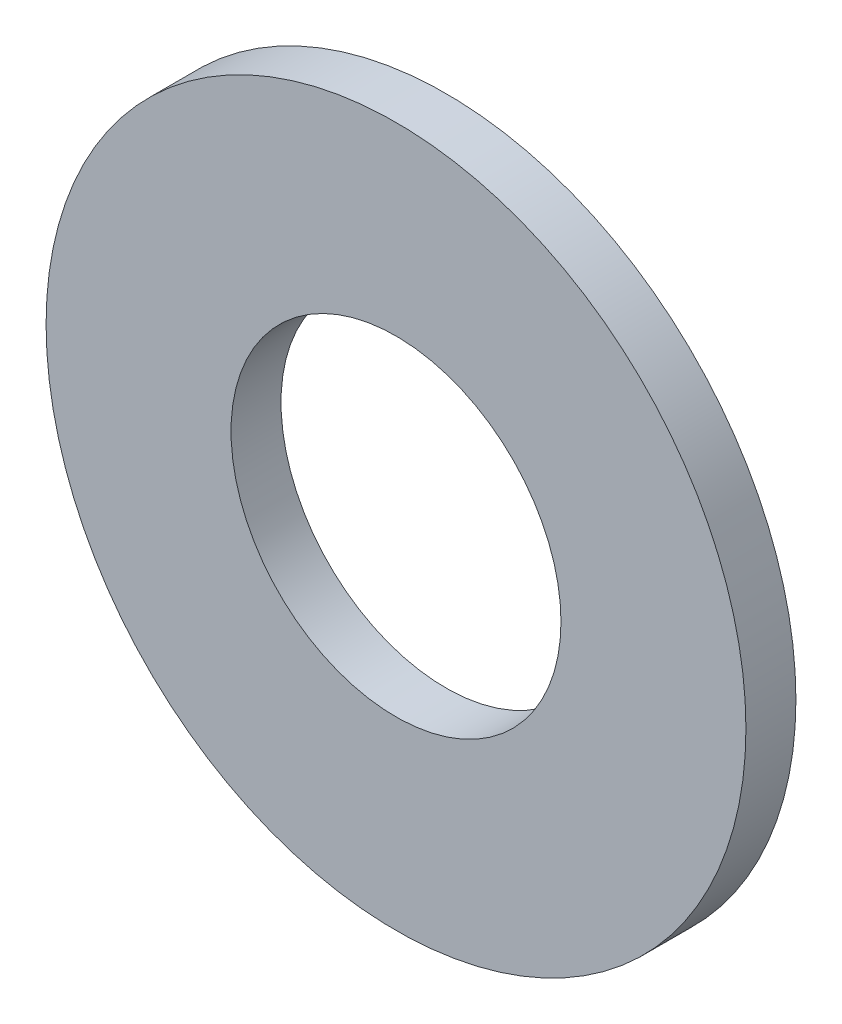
SolidWorks part; units mm, degrees
ref_plane "Plan de face" through (0, 0, 0) normal (0, 0, 1) x (1, 0, 0)
ref_plane "Plan de dessus" through (0, 0, 0) normal (0, 1, 0) x (1, 0, 0)
ref_plane "Plan de droite" through (0, 0, 0) normal (1, 0, 0) x (0, 0, -1)
sketch "Esquisse1" plane through (0, 0, 0) normal (0, 0, 1) x (1, 0, 0)
  circle A0 centre (0, 0) radius 3.5
  circle A1 centre (0, 0) radius 1.65
extrude "Extrusion1" add sketch "Esquisse1" along normal blind 0.5
